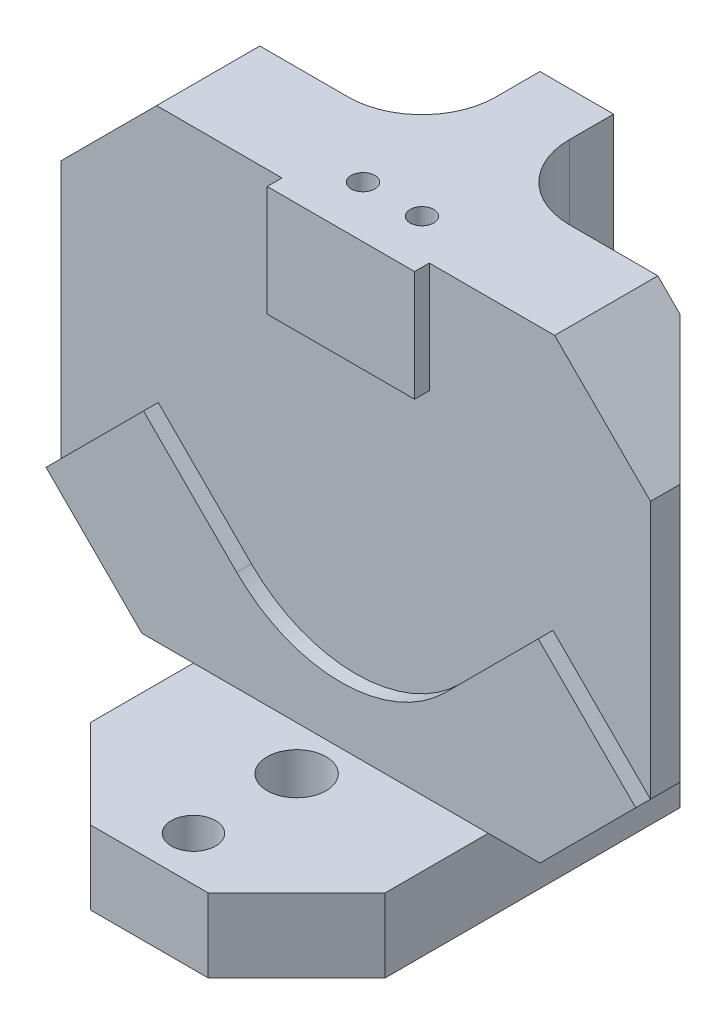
SolidWorks part; units mm, degrees
ref_plane "Front" through (0, 0, 0) normal (0, 0, 1) x (1, 0, 0)
ref_plane "Top" through (0, 0, 0) normal (0, 1, 0) x (1, 0, 0)
ref_plane "Right" through (0, 0, 0) normal (1, 0, 0) x (0, 0, -1)
sketch "Эскиз1" plane through (0, 0, 0) normal (0, 0, 1) x (1, 0, 0)
  line L1 (20, -15) -> (-20, -15)
  line L2 (20, -15) -> (20, 15)
  line L3 (20, 15) -> (-20, 15)
  line L4 (-20, -15) -> (-20, 15)
  line L5 (20, -15) -> (-20, 15) construction
  line L6 (20, 15) -> (-20, -15) construction
  point P0 (0, 0)
  dimension "D1" = 40
  dimension "D2" = 30
extrude "Бобышка-Вытянуть1" add sketch "Эскиз1" along normal blind 7
chamfer "Фаска1" distance 6.5 angle 45 2 edges at (-20, -15, 3.5) (20, -15, 3.5)
sketch "Эскиз2" plane through (0, -15, 0) normal (0, -1, 0) x (-1, 0, 0)
  line L0 (0, 0) -> (0, -7) construction
  line L1 (13.5, -7) -> (-13.5, -7) construction
  line L3 (10, -21) -> (-10, -21)
  line L4 (10, -21) -> (10, 14)
  line L5 (10, 14) -> (-10, 14)
  line L6 (-10, -21) -> (-10, 14)
  line L7 (10, -21) -> (-10, 14) construction
  line L8 (10, 14) -> (-10, -21) construction
  point P5 (0, -3.5)
  dimension "D1" = 20
  dimension "D2" = 35
extrude "Бобышка-Вытянуть2" add sketch "Эскиз2" along normal blind 5
chamfer "Фаска2" distance 6 angle 45 4 edges at (-10, -17.5, -14) (-10, -17.5, 21) (10, -17.5, 21) (10, -17.5, -14)
sketch "Эскиз3" plane through (0, -15, 0) normal (0, 1, 0) x (1, 0, 0)
  line L0 (0, 0) -> (0, 4) construction
  line L1 (-10, 0) -> (10, 0) construction
  line L3 (2.5, 8) -> (-2.5, 8)
  line L4 (2.5, 8) -> (2.5, 0)
  line L5 (2.5, 0) -> (-2.5, 0)
  line L6 (-2.5, 8) -> (-2.5, 0)
  line L7 (2.5, 8) -> (-2.5, 0) construction
  line L8 (2.5, 0) -> (-2.5, 8) construction
  dimension "D1" = 4
  dimension "D2" = 5
extrude "Бобышка-Вытянуть3" add sketch "Эскиз3" along normal up to surface (30 mm away)
fillet "Скругление1" radius 5 2 edges at (2.5, 0, 0) (-2.5, 0, 0)
sketch "Эскиз4" plane through (0, 0, 7) normal (0, 0, 1) x (1, 0, 0)
  line L0 (19.8995, -5.1005) -> (15.0346, -0.2356)
  line L1 (15.0346, -0.2356) -> (7.0711, -8.1991)
  line L3 (0.1005, -15) -> (10, -15)
  line L4 (10, -15) -> (19.8995, -5.1005)
  line L5 (-19.8995, -5.1005) -> (-15.0346, -0.2356)
  line L6 (-15.0346, -0.2356) -> (-7.0711, -8.1991)
  line L7 (-0.1005, -15) -> (-10, -15)
  line L8 (-10, -15) -> (-19.8995, -5.1005)
  line L9 (0, 15) -> (0, 11.5) construction
  line L10 (20, 15) -> (-20, 15) construction
  line L12 (-5, 8) -> (5, 8)
  line L13 (-5, 8) -> (-5, 15)
  line L14 (-5, 15) -> (5, 15)
  line L15 (5, 8) -> (5, 15)
  line L16 (-5, 8) -> (5, 15) construction
  line L17 (-5, 15) -> (5, 8) construction
  arc A0 (-7.0711, -8.1991) -> (7.0711, -8.1991) centre (0, -1.1281) ccw
  dimension "D5" = 10
  dimension "D1" = 6.88
  dimension "D2" = 6.88
  dimension "D3" = 14
  dimension "D4" = 14
  dimension "D6" = 3.5
  dimension "D7" = 10
extrude "Бобышка-Вытянуть4" add sketch "Эскиз4" along normal blind 1
chamfer "Фаска3" distance 5 angle 45 2 edges at (-20, 3.25, 0) (20, 3.25, 0)
sketch "Эскиз5" plane through (0, 15, 0) normal (0, 1, 0) x (1, 0, 0)
  line L0 (0, -8) -> (0, -4.5) construction
  line L1 (5, -8) -> (-5, -8) construction
  line L2 (0, -4.5) -> (2, -4.5) construction
  circle A0 centre (2, -4.5) radius 0.5
  circle A1 centre (-2, -4.5) radius 0.5
  dimension "D3" = 1
  dimension "D1" = 2
  dimension "D2" = 3.5
extrude "Вырез-Вытянуть1" cut sketch "Эскиз5" against normal blind 5
hole_wizard "Отверстие обработанное метчиком M21" positions "Эскиз6" profile "Эскиз7" tap size "M2" standard "ISO"
sketch "Эскиз6" plane through (0, 15, 0) normal (0, 1, 0) x (1, 0, 0)
  point P0 (2, -4.5)
  point P3 (-2, -4.5)
sketch "Эскиз7" plane through (2, 15, 4.5) normal (1, 0, 0) x (0, 0, 1)
  line L0 (0, 0) -> (0, 6.4807)
  line L1 (0, 6.4807) -> (0.8, 6)
  line L2 (0.8, 6) -> (0.8, 0)
  line L5 (0.8, 0) -> (0, 0)
  line L10 (0, 6.4807) -> (-0.8, 6) construction
  line L11 (0, -6.35) -> (0, 107.95) construction
  dimension "Диаметр сверла" = 1.6
  dimension "Глубина сверла" = 6
  dimension "Угол заточки сверла" = 118
sketch "Эскиз8" plane through (14.25, -14.25, 0) normal (0.7071, -0.7071, 0) x (-0.7071, -0.7071, 0)
  line L0 (1.0607, -7) -> (1.0607, -4.5) construction
  line L1 (1.0607, 0) -> (1.0607, -7) construction
  line L2 (1.0607, -4.5) -> (-0.9393, -4.5) construction
  line L3 (-0.9393, -4.5) -> (-4.9393, -4.5) construction
  circle A0 centre (-0.9393, -4.5) radius 0.5
  circle A1 centre (-4.9393, -4.5) radius 0.5
  dimension "D4" = 1
  dimension "D5" = 1
  dimension "D1" = 4
  dimension "D2" = 2
  dimension "D3" = 2.5
extrude "Вырез-Вытянуть2" cut sketch "Эскиз8" against normal blind 5
hole_wizard "Отверстие обработанное метчиком M22" positions "Эскиз9" profile "Эскиз10" tap size "M2" standard "ISO"
sketch "Эскиз9" plane through (14.25, -14.25, 0) normal (0.7071, -0.7071, 0) x (-0.7071, -0.7071, 0)
  point P0 (-4.9393, -4.5)
  point P3 (-0.9393, -4.5)
sketch "Эскиз10" plane through (17.7426, -10.7574, 4.5) normal (0, 0, 1) x (0.7071, 0.7071, 0)
  line L0 (0, 0) -> (0, 6.4807)
  line L1 (0, 6.4807) -> (0.8, 6)
  line L2 (0.8, 6) -> (0.8, 0)
  line L5 (0.8, 0) -> (0, 0)
  line L10 (0, 6.4807) -> (-0.8, 6) construction
  line L11 (0, -6.35) -> (0, 107.95) construction
  dimension "Диаметр сверла" = 1.6
  dimension "Глубина сверла" = 6
  dimension "Угол заточки сверла" = 118
sketch "Эскиз11" plane through (-14.25, -14.25, 0) normal (-0.7071, -0.7071, 0) x (0, 0, 1)
  line L0 (7, -1.0607) -> (4.5, -1.0607) construction
  line L1 (7, -1.0607) -> (0, -1.0607) construction
  line L2 (4.5, -1.0607) -> (4.5, 0.9393) construction
  line L3 (4.5, 0.9393) -> (4.5, 4.9393) construction
  line L4 (7, 8.1317) -> (7, -1.0607) construction
  circle A0 centre (4.5, 4.9393) radius 0.5
  circle A1 centre (4.5, 0.9393) radius 0.5
  dimension "D3" = 1
  dimension "D4" = 1
  dimension "D1" = 2
  dimension "D2" = 4
  dimension "D5" = 2.5
extrude "Вырез-Вытянуть3" cut sketch "Эскиз11" against normal blind 5
hole_wizard "Отверстие обработанное метчиком M23" positions "Эскиз12" profile "Эскиз13" tap size "M2" standard "ISO"
sketch "Эскиз12" plane through (-14.25, -14.25, 0) normal (-0.7071, -0.7071, 0) x (0, 0, 1)
  point P0 (4.5, 0.9393)
  point P3 (4.5, 4.9393)
sketch "Эскиз13" plane through (-14.9142, -13.5858, 4.5) normal (0, 0, 1) x (0.7071, -0.7071, 0)
  line L0 (0, 0) -> (0, 6.4807)
  line L1 (0, 6.4807) -> (0.8, 6)
  line L2 (0.8, 6) -> (0.8, 0)
  line L5 (0.8, 0) -> (0, 0)
  line L10 (0, 6.4807) -> (-0.8, 6) construction
  line L11 (0, -6.35) -> (0, 107.95) construction
  dimension "Диаметр сверла" = 1.6
  dimension "Глубина сверла" = 6
  dimension "Угол заточки сверла" = 118
sketch "Эскиз15" plane through (12.5, -12.5, 0) normal (0.7071, -0.7071, 0) x (-0.7071, -0.7071, 0)
  line L1 (3.5355, -8) -> (-10.4645, -8)
  line L2 (3.5355, -8) -> (3.5355, -7)
  line L3 (3.5355, -7) -> (-10.4645, -7)
  line L4 (-10.4645, -8) -> (-10.4645, -7)
extrude "Бобышка-Вытянуть5" add sketch "Эскиз15" along normal blind 5
sketch "Эскиз16" plane through (-12.5, -12.5, 0) normal (-0.7071, -0.7071, 0) x (-0.7071, 0.7071, 0)
  line L1 (-3.5355, -8) -> (10.4645, -8)
  line L2 (-3.5355, -8) -> (-3.5355, -7)
  line L3 (-3.5355, -7) -> (10.4645, -7)
  line L4 (10.4645, -8) -> (10.4645, -7)
extrude "Бобышка-Вытянуть6" add sketch "Эскиз16" along normal blind 5
sketch "Эскиз17" plane through (0, 0, 7) normal (0, 0, -1) x (-1, 0, 0)
  line L0 (13.5355, -18.5355) -> (10, -15)
  line L1 (10, -15) -> (13.5, -15)
  line L2 (13.5, -15) -> (20, -8.5)
  line L3 (20, -8.5) -> (20, -5.201)
  line L4 (20, -5.201) -> (23.435, -8.636)
  line L5 (23.435, -8.636) -> (13.5355, -18.5355)
  line L6 (-20, -8.5) -> (-20, -5.201)
  line L7 (-20, -5.201) -> (-23.435, -8.636)
  line L8 (-23.435, -8.636) -> (-13.5355, -18.5355)
  line L9 (-13.5355, -18.5355) -> (-10, -15)
  line L10 (-10, -15) -> (-13.5, -15)
  line L11 (-13.5, -15) -> (-20, -8.5)
  line L12 (-20, -8.5) -> (-20.0263, -8.0755)
extrude "Вырез-Вытянуть4" cut sketch "Эскиз17" against normal blind 5
sketch "Эскиз18" plane through (9, 0, -9) normal (0.7071, 0, -0.7071) x (-0.7071, 0, -0.7071)
  circle A0 centre (2.7045, -17.5871) radius 12.0806
extrude "Вырез-Вытянуть5" cut sketch "Эскиз18" against normal blind 2
sketch "Эскиз19" plane through (-9, 0, -9) normal (-0.7071, 0, -0.7071) x (-0.7071, 0, 0.7071)
  circle A0 centre (-2.5983, -17.5538) radius 10.1184
extrude "Вырез-Вытянуть6" cut sketch "Эскиз19" against normal blind 2
sketch "Эскиз20" plane through (0, -15, 0) normal (0, 1, 0) x (1, 0, 0)
  line L0 (0, 8) -> (0, 10.5) construction
  line L1 (2.5, 8) -> (-2.5, 8) construction
  line L4 (0, -21) -> (0, -18) construction
  line L5 (4, -21) -> (-4, -21) construction
  circle A0 centre (0, 10.5) radius 0.85
  circle A2 centre (-6.5, 4) radius 1.5
  circle A3 centre (6.5, 4) radius 1.5
  circle A4 centre (0, -18) radius 1.5
  dimension "D2" = 1.7
  dimension "D4" = 3
  dimension "D6" = 3
  dimension "D7" = 6.5
  dimension "D3" = 6.5
  dimension "D1" = 2.5
  dimension "D5" = 3
extrude "Вырез-Вытянуть7" cut sketch "Эскиз20" against normal through all
sketch "Эскиз21" plane through (0, -15, 0) normal (0, 1, 0) x (1, 0, 0)
  line L0 (0, -18) -> (0, -11) construction
  circle A0 centre (0, -11) radius 2
  dimension "D2" = 4
  dimension "D1" = 7
extrude "Вырез-Вытянуть8" cut sketch "Эскиз21" against normal blind 10
sketch "Эскиз22" plane through (0, 0, 8) normal (0, 0, 1) x (1, 0, 0)
  line L0 (-20, -8.5) -> (-13.3851, -1.8851)
  line L1 (-15.0346, -0.2356) -> (-7.0711, -8.1991) construction
  line L2 (-13.3851, -1.8851) -> (-15.0346, -0.2356)
  line L3 (-20, -5.201) -> (-15.0346, -0.2356) construction
  line L4 (-15.0346, -0.2356) -> (-20, -5.201)
  line L5 (-20, -5.201) -> (-20, -8.5)
  line L6 (15.0346, -0.2356) -> (20, -5.201)
  line L7 (20, -5.201) -> (20, -8.5)
  line L8 (20, -8.5) -> (13.3851, -1.8851)
  line L9 (15.0346, -0.2356) -> (7.0711, -8.1991) construction
  line L10 (13.3851, -1.8851) -> (15.0346, -0.2356)
extrude "Вырез-Вытянуть9" cut sketch "Эскиз22" against normal blind 1
sketch "Эскиз23" plane through (-7.5858, 0, -7.5858) normal (-0.7071, 0, -0.7071) x (-0.7071, 0, 0.7071)
  line L1 (3.4142, -15) -> (-9.0711, -15)
  line L2 (3.4142, -15) -> (3.4142, -20)
  line L3 (3.4142, -20) -> (-9.0711, -20)
  line L4 (-9.0711, -15) -> (-9.0711, -20)
extrude "Бобышка-Вытянуть7" add sketch "Эскиз23" along normal blind 20
sketch "Эскиз24" plane through (7.5858, 0, -7.5858) normal (0.7071, 0, -0.7071) x (-0.7071, 0, -0.7071)
  line L1 (9.0711, -15) -> (-3.4142, -15)
  line L2 (9.0711, -15) -> (9.0711, -20)
  line L3 (9.0711, -20) -> (-3.4142, -20)
  line L4 (-3.4142, -15) -> (-3.4142, -20)
extrude "Бобышка-Вытянуть8" add sketch "Эскиз24" along normal blind 20
sketch "Эскиз25" plane through (0, -15, 0) normal (0, 1, 0) x (1, 0, 0)
  line L1 (1.1716, 14) -> (31.2807, 14)
  line L3 (1.1716, 37.467) -> (31.2807, 37.467)
  line L4 (31.2807, 14) -> (31.2807, 37.467)
  line L5 (1.1716, 14) -> (-31.8925, 14)
  line L6 (1.1716, 37.467) -> (1.1716, 43.2299)
  line L7 (1.1716, 43.2299) -> (-31.8925, 43.2299)
  line L8 (-31.8925, 14) -> (-31.8925, 43.2299)
extrude "Вырез-Вытянуть10" cut sketch "Эскиз25" against normal blind 20
sketch "Эскиз26" plane through (-10, 0, 0) normal (-1, 0, 0) x (0, 0, 1)
  line L1 (-5.1716, -15) -> (-27.9528, -15)
  line L2 (-5.1716, -15) -> (-5.1716, -32.3516)
  line L3 (-5.1716, -32.3516) -> (-27.9528, -32.3516)
  line L4 (-27.9528, -15) -> (-27.9528, -32.3516)
extrude "Вырез-Вытянуть11" cut sketch "Эскиз26" along normal blind 20
sketch "Эскиз27" plane through (10, 0, 0) normal (1, 0, 0) x (0, 0, -1)
  line L1 (5.1716, -15) -> (23.9107, -15)
  line L2 (5.1716, -15) -> (5.1716, -30.4152)
  line L3 (5.1716, -30.4152) -> (23.9107, -30.4152)
  line L4 (23.9107, -15) -> (23.9107, -30.4152)
extrude "Вырез-Вытянуть12" cut sketch "Эскиз27" along normal blind 20
chamfer "Фаска4" distance 9 angle 45 2 edges at (-10, -17.5, -14) (10, -17.5, -14)
sketch "Эскиз28" plane through (0, 15, 0) normal (0, 1, 0) x (1, 0, 0)
  line L0 (-7.5, 0) -> (-15, 0)
  line L1 (-15, 0) -> (-20, -5)
  line L2 (-20, -5) -> (-20, -7)
  line L3 (-20, -7) -> (-5, -7)
  line L4 (-5, -7) -> (-5, -8)
  line L5 (-5, -8) -> (5, -8)
  line L6 (5, -8) -> (5, -7)
  line L7 (5, -7) -> (20, -7)
  line L8 (20, -7) -> (20, -5)
  line L9 (20, -5) -> (15, 0)
  line L10 (15, 0) -> (7.5, 0)
  line L11 (2.5, 5) -> (2.5, 8)
  line L12 (2.5, 8) -> (-2.5, 8)
  line L13 (-2.5, 8) -> (-2.5, 5)
  arc A0 (2.5, 5) -> (7.5, 0) centre (7.5, 5) ccw
  arc A1 (-7.5, 0) -> (-2.5, 5) centre (-7.5, 5) ccw
  circle A2 centre (-2, -4.5) radius 0.8
  circle A3 centre (2, -4.5) radius 0.8
extrude "Бобышка-Вытянуть9" add sketch "Эскиз28" along normal blind 0.5
chamfer "Фаска5" distance 6.5 angle 45 2 edges at (-20, 15.5, 6) (20, 15.5, 6)
